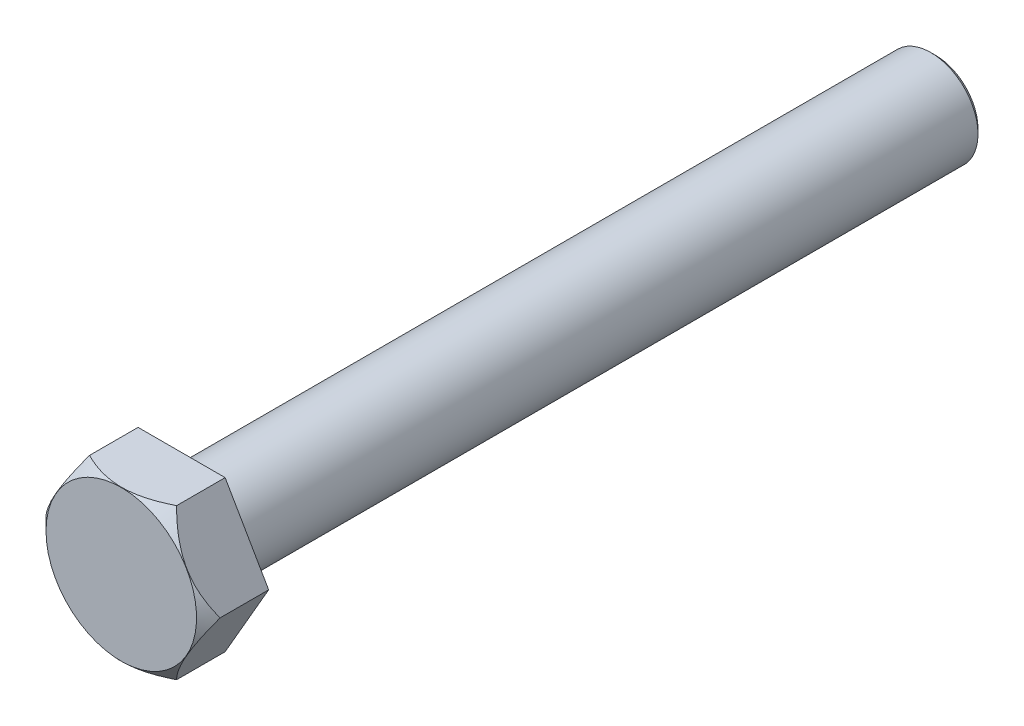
SolidWorks part; units mm, degrees
ref_plane "Plan de face" through (0, 0, 0) normal (0, 0, 1) x (1, 0, 0)
ref_plane "Plan de dessus" through (0, 0, 0) normal (0, 1, 0) x (1, 0, 0)
ref_plane "Plan de droite" through (0, 0, 0) normal (1, 0, 0) x (0, 0, -1)
sketch "Esquisse1" plane through (0, 0, 0) normal (0, 0, 1) x (1, 0, 0)
  line L1 (9.2376, 0) -> (4.6188, 8)
  line L2 (4.6188, 8) -> (-4.6188, 8)
  line L3 (-4.6188, 8) -> (-9.2376, 0)
  line L4 (-9.2376, 0) -> (-4.6188, -8)
  line L5 (-4.6188, -8) -> (4.6188, -8)
  line L6 (4.6188, -8) -> (9.2376, 0)
  circle A0 centre (0, 0) radius 8 construction
  dimension "D1" = 16
extrude "Boss.-Extru.1" add sketch "Esquisse1" along normal blind 6.4
sketch "Esquisse3" plane through (0, 0, 0) normal (0, 1, 0) x (1, 0, 0)
  line L0 (0, 2.9031) -> (0, -10.4428) construction
  line L1 (-9.2376, -5.15) -> (-7.9876, -6.4)
  line L2 (-10.1543, -8.0782) -> (-7.9876, -8.0782)
  line L3 (-10.1543, -8.0782) -> (-10.1543, -5.15)
  line L4 (-10.1543, -5.15) -> (-9.2376, -5.15)
  line L5 (-7.9876, -8.0782) -> (-7.9876, -6.4)
  line L6 (-9.2376, -6.4) -> (-9.2376, 0) construction
  line L8 (-4.6188, -6.4) -> (-9.2376, -6.4) construction
  dimension "D1" = 1.25
  dimension "D2" = 1.25
revolve "Enlèvement de matière-Révolution2" cut sketch "Esquisse3" angle 360 about L0
sketch "Esquisse4" plane through (0, 0, 0) normal (1, 0, 0) x (0, 0, -1)
  line L0 (0, 0) -> (83.8832, 0) construction
  line L1 (0, -5) -> (79.5, -5)
  line L2 (0, -8) -> (0, 0) construction
  line L3 (80, -4.5) -> (80, 0)
  line L4 (79.5, -5) -> (80, -4.5)
  line L5 (0, -5) -> (0, 0)
  line L6 (0, 0) -> (80, 0)
  point P4 (80, -5)
  dimension "D1" = 5
  dimension "D2" = 80
  dimension "D6" = 0.5
revolve "Révolution2" add sketch "Esquisse4" angle 360 about L0
